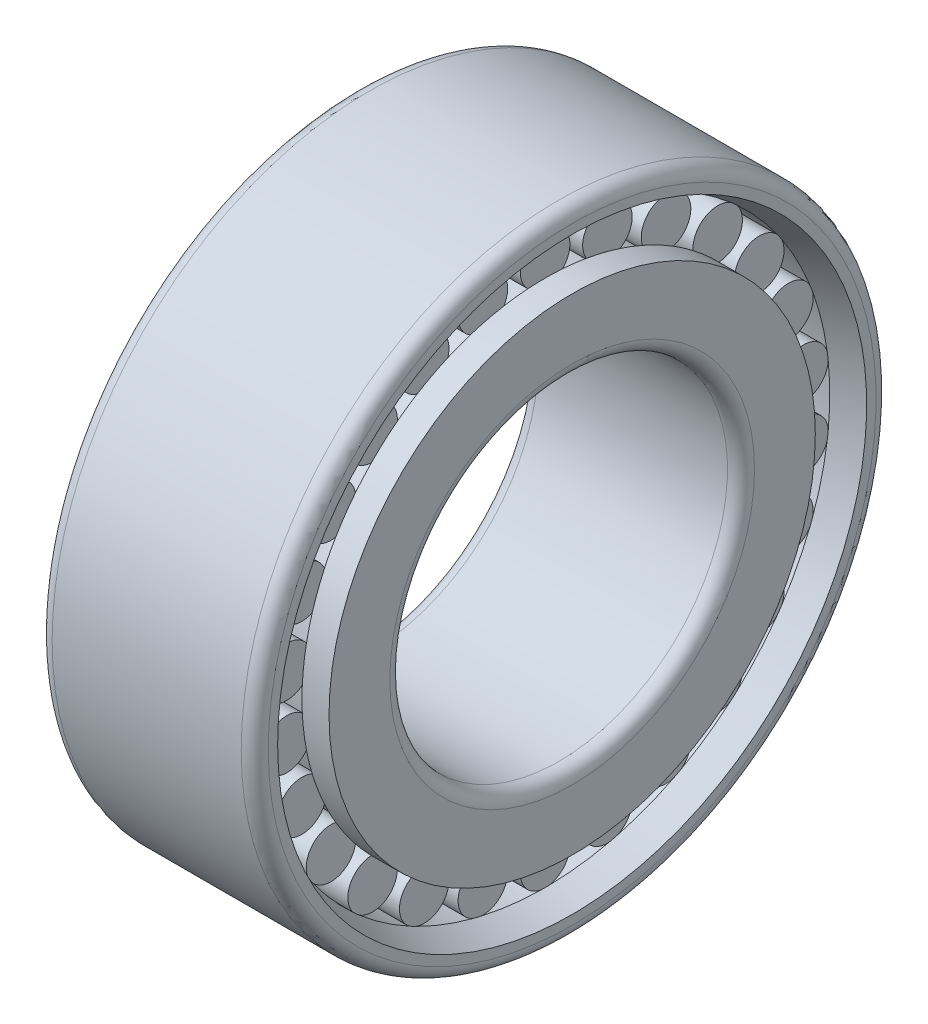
SolidWorks part; units mm, degrees
ref_plane "Front" through (0, 0, 0) normal (0, 0, 1) x (1, 0, 0)
ref_plane "Top" through (0, 0, 0) normal (0, 1, 0) x (1, 0, 0)
ref_plane "Right" through (0, 0, 0) normal (1, 0, 0) x (0, 0, -1)
sketch "Sketch1" plane through (0, 0, 0) normal (0, 0, 1) x (1, 0, 0)
  line L0 (-29.0544, 0) -> (27.0644, 0) construction
  line L1 (-8, 18) -> (-8, 12.5)
  line L2 (-8, 12.5) -> (8, 12.5)
  line L3 (8, 12.5) -> (8, 18)
  line L4 (-8, 18) -> (-6, 18)
  line L5 (-6, 18) -> (-6, 17.45)
  line L6 (-6, 17.45) -> (-2, 17.45)
  line L7 (-2, 17.45) -> (-2, 18)
  line L8 (-2, 18) -> (2, 18)
  line L9 (2, 18) -> (2, 17.45)
  line L10 (2, 17.45) -> (6, 17.45)
  line L11 (6, 17.45) -> (6, 18)
  line L12 (6, 18) -> (8, 18)
  point P2 (0, 18)
  dimension "B" = 16
  dimension "d" = 25
  dimension "D3" = 5.5
  dimension "D4" = 4
  dimension "D5" = 2
  dimension "D6" = 0.55
revolve "Revolve1" add sketch "Sketch1" angle 360 about L0
sketch "Sketch2" plane through (0, 0, 0) normal (0, 0, 1) x (1, 0, 0)
  line L0 (-4.6117, 19.2633) -> (32.9787, 19.2633) construction
  line L1 (-6, -18) -> (-6, 18) construction
  line L2 (-2, 18) -> (-2, -18) construction
  line L3 (2, 19.2633) -> (6, 19.2633)
  line L4 (2, 21.0967) -> (2, 19.2633)
  line L5 (2, -18) -> (2, 18) construction
  line L6 (6, 21.0967) -> (6, 19.2633)
  line L7 (-6, 19.2633) -> (-2, 19.2633)
  line L8 (-6, 21.0967) -> (-6, 19.2633)
  line L9 (6, 17.45) -> (2, 17.45) construction
  line L10 (-2, 21.0967) -> (-2, 19.2633)
  line L11 (6, 18) -> (6, -18) construction
  line L15 (-6, 21.0967) -> (-2, 21.0967)
  line L16 (2, 21.0967) -> (6, 21.0967)
  dimension "D1" = 1.8333
  dimension "D2" = 1.8133
revolve "Revolve2" add sketch "Sketch2" angle 360 about L0
sketch "Sketch3" plane through (0, 0, 0) normal (0, 0, 1) x (1, 0, 0)
  line L0 (-4.4301, 0) -> (28.9264, 0) construction
  line L2 (6, 21.0767) -> (8, 21.8046)
  line L4 (8, 21.8046) -> (8, 23.5)
  line L5 (8, 23.5) -> (-8, 23.5)
  line L6 (-8, 23.5) -> (-8, 21.8046)
  line L7 (-8, 21.8046) -> (-6, 21.0767)
  line L8 (-8, 18) -> (-8, -18) construction
  line L9 (-6, 21.0767) -> (6, 21.0767)
  dimension "D1" = 20
  dimension "DD" = 47
  dimension "D2" = 21.0767
  dimension "D3" = 12
  dimension "B" = 16
  dimension "D4" = 2
revolve "Revolve3" add sketch "Sketch3" angle 360 about L0
pattern_circular "Circular-Pattern1" count 26 over 360 about axis through (0, 0, 0) along (1, 0, 0) of "Revolve2"
fillet "Fillet1" radius 1 4 edges at (-8, 0, 12.5) (-8, 0, 23.5) (8, 0, 12.5) (8, 0, 23.5)
equation "\"D3@Sketch1\" =  ( \"DD@Sketch3\" - \"d@Sketch1\" ) / 4"
equation "\"D5@Sketch1\" = \"B@Sketch1\" / 8"
equation "\"D4@Sketch1\" = \"B@Sketch1\" / 4"
equation "\"D6@Sketch1\" = \"D3@Sketch1\" / 10"
equation "\"D1@Sketch2\" = ( \"DD@Sketch3\" - \"d@Sketch1\" ) / 12"
equation "\"D2@Sketch2\" = \"D1@Sketch2\" - 0.02"
equation "\"B@Sketch3\" = \"B@Sketch1\""
equation "\"D2@Sketch3\" = \"d@Sketch1\" / 2 + \"D3@Sketch1\" - \"D6@Sketch1\" + 2 * \"D1@Sketch2\" - 0.04 "
equation "\"D3@Sketch3\" = \"B@Sketch3\" * 0.75"
equation "\"D4@Sketch3\" = \"B@Sketch3\" / 8"
equation "\"D1@Circular-Pattern1\" =int(3.141593/atn(\"D1@Sketch2\"/sqr((\"d@Sketch1\"/2+\"D3@Sketch1\"-\"D6@Sketch1\"+\"D2@Sketch2\")*(\"d@Sketch1\"/2+\"D3@Sketch1\"-\"D6@Sketch1\"+\"D2@Sketch2\")-(\"D1@Sketch2\"*\"D1@Sketch2\")))) -"
